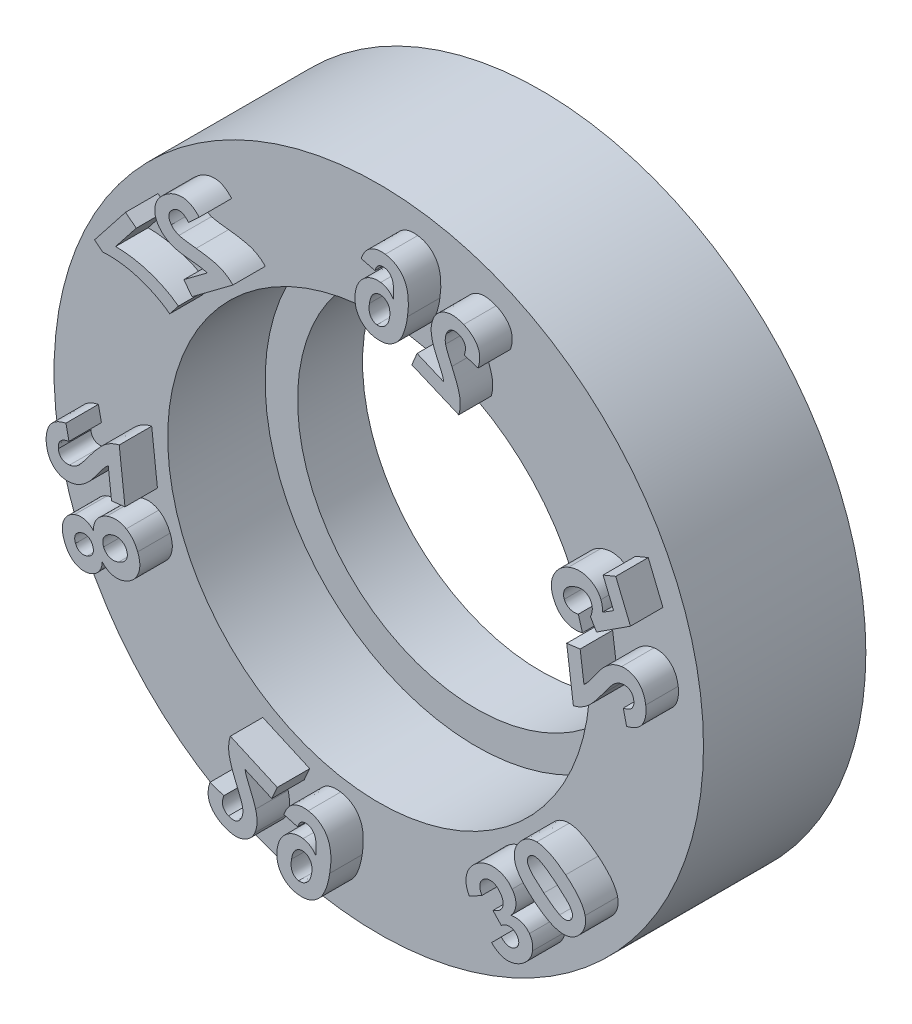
SolidWorks part; units mm, degrees
ref_plane "Front Plane" through (0, 0, 0) normal (0, 0, 1) x (1, 0, 0)
ref_plane "Top Plane" through (0, 0, 0) normal (0, 1, 0) x (1, 0, 0)
ref_plane "Right Plane" through (0, 0, 0) normal (1, 0, 0) x (0, 0, -1)
imported_body "Imported1"
other "DeleteFace1"
sketch "Sketch1" plane through (0, 0, 0) normal (0, 0, 1) x (1, 0, 0)
  line L0 (0, 0) -> (0, 11.8635) construction
  line L1 (0, 0) -> (10.2741, 5.9318) construction
  line L2 (0, 0) -> (10.2741, -5.9318) construction
  line L3 (0, 0) -> (0, -11.8635) construction
  line L4 (0, 0) -> (-10.2741, -5.9318) construction
  line L5 (0, 0) -> (-10.2741, 5.9318) construction
  circle A0 centre (0, 0) radius 7.0035 construction
  text T0 "25    26    27    28    29    30" font "Arial" height 2.37
  point P12 (0, 0)
  dimension "D1" = 6
extrude "Boss-Extrude1" add sketch "Sketch1" along normal blind 1
